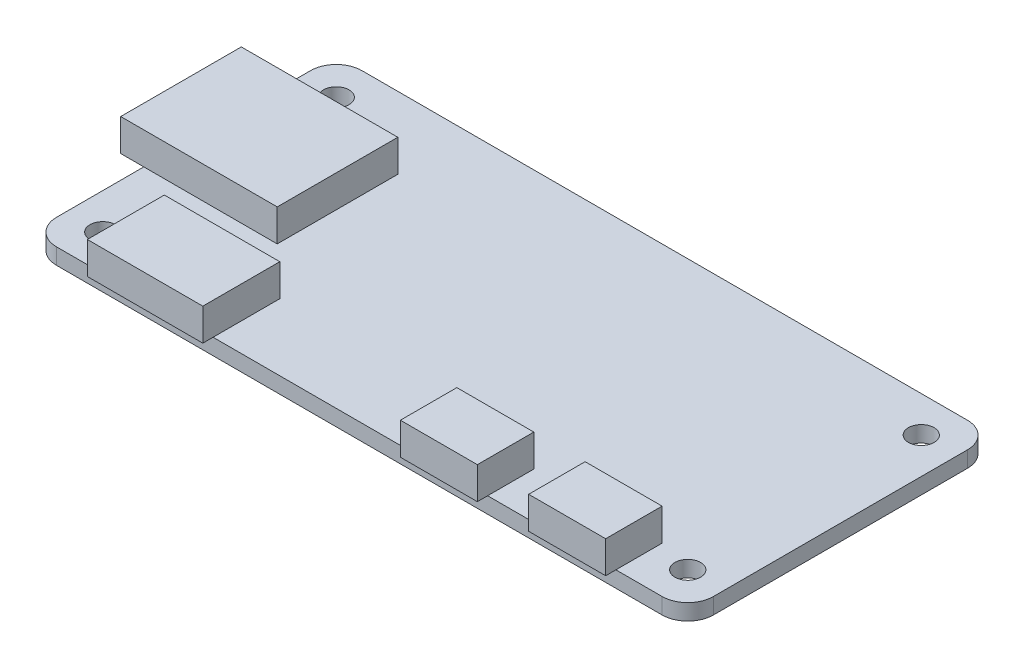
SolidWorks part; units mm, degrees
ref_plane "Front Plane" through (0, 0, 0) normal (0, 0, 1) x (1, 0, 0)
ref_plane "Top Plane" through (0, 0, 0) normal (0, 1, 0) x (1, 0, 0)
ref_plane "Right Plane" through (0, 0, 0) normal (1, 0, 0) x (0, 0, -1)
sketch "Sketch1" plane through (0, 0, 0) normal (0, 1, 0) x (1, 0, 0)
  line L1 (2.54, 0) -> (62.484, 0)
  line L2 (0, 2.54) -> (0, 27.686)
  line L3 (2.54, 30.226) -> (62.484, 30.226)
  line L4 (65.024, 2.54) -> (65.024, 27.686)
  arc A0 (2.54, 0) -> (0, 2.54) centre (2.54, 2.54) cw
  arc A1 (62.484, 0) -> (65.024, 2.54) centre (62.484, 2.54) ccw
  arc A2 (62.484, 30.226) -> (65.024, 27.686) centre (62.484, 27.686) cw
  arc A3 (0, 27.686) -> (2.54, 30.226) centre (2.54, 27.686) cw
  circle A4 centre (3.556, 26.67) radius 1.27
  circle A5 centre (3.556, 3.556) radius 1.27
  circle A6 centre (61.468, 3.556) radius 1.27
  circle A7 centre (61.468, 26.67) radius 1.27
  point P7 (0, 0)
  point P12 (65.024, 30.226)
  point P15 (0, 30.226)
  dimension "D3" = 2.54
  dimension "D4" = 2.54
  dimension "D7" = 2.54
  dimension "D9" = 2.54
  dimension "D11" = 2.54
  dimension "D1" = 30.226
  dimension "D2" = 65.024
  dimension "D5" = 3.556
  dimension "D6" = 3.556
  dimension "D8" = 3.556
  dimension "D10" = 3.556
extrude "Boss-Extrude1" add sketch "Sketch1" along normal blind 1.5875
sketch "Sketch2" plane through (0, 1.5875, 0) normal (0, 1, 0) x (1, 0, 0)
  line L0 (0, 27.686) -> (0, 2.54) construction
  line L1 (50.292, 4.572) -> (57.912, 4.572)
  line L2 (50.292, 4.572) -> (50.292, -1.016)
  line L3 (50.292, -1.016) -> (57.912, -1.016)
  line L4 (57.912, 4.572) -> (57.912, -1.016)
  line L5 (37.592, 4.572) -> (45.212, 4.572)
  line L6 (37.592, 4.572) -> (37.592, -1.016)
  line L7 (37.592, -1.016) -> (45.212, -1.016)
  line L8 (45.212, 4.572) -> (45.212, -1.016)
  line L9 (6.604, 6.604) -> (18.034, 6.604)
  line L10 (6.604, 6.604) -> (6.604, -1.016)
  line L11 (6.604, -1.016) -> (18.034, -1.016)
  line L12 (18.034, 6.604) -> (18.034, -1.016)
  line L13 (13.208, 23.114) -> (-2.286, 23.114)
  line L14 (13.208, 23.114) -> (13.208, 11.176)
  line L15 (13.208, 11.176) -> (-2.286, 11.176)
  line L16 (-2.286, 23.114) -> (-2.286, 11.176)
  line L17 (62.484, 30.226) -> (2.54, 30.226) construction
  line L18 (2.54, 0) -> (62.484, 0) construction
  line L19 (65.024, 2.54) -> (65.024, 27.686) construction
  point P22 (41.402, 4.572)
  dimension "D1" = 11.938
  dimension "D2" = 11.43
  dimension "D3" = 7.62
  dimension "D4" = 7.62
  dimension "D5" = 5.588
  dimension "D6" = 5.588
  dimension "D7" = 7.62
  dimension "D8" = 15.494
  dimension "D9" = 2.286
  dimension "D10" = 7.112
  dimension "D11" = 6.604
  dimension "D12" = 6.604
  dimension "D13" = 4.572
  dimension "D14" = 4.572
  dimension "D15" = 7.112
  dimension "D16" = 19.812
extrude "Boss-Extrude2" add sketch "Sketch2" along normal blind 3.175
